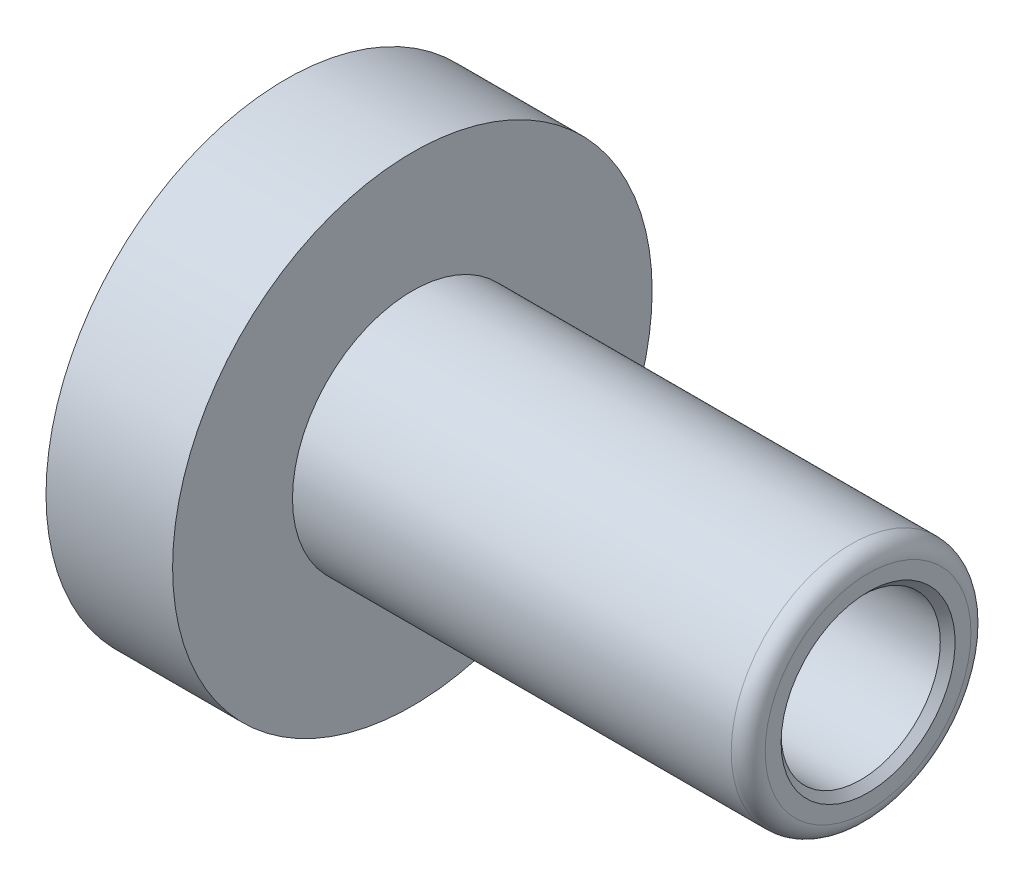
SolidWorks part; units mm, degrees
ref_plane "Front Plane" through (0, 0, 0) normal (0, 0, 1) x (1, 0, 0)
ref_plane "Top Plane" through (0, 0, 0) normal (0, 1, 0) x (1, 0, 0)
ref_plane "Right Plane" through (0, 0, 0) normal (1, 0, 0) x (0, 0, -1)
sketch "Sketch1" plane through (0, 0, 0) normal (0, 0, 1) x (1, 0, 0)
  line L0 (0, 0) -> (102.3864, 0) construction
  line L1 (0, 8.128) -> (0, 22.225)
  line L2 (0, 22.225) -> (11.7348, 22.225)
  line L3 (11.7348, 22.225) -> (11.7348, 11.1125)
  line L4 (11.7348, 11.1125) -> (52.4002, 11.1125)
  line L5 (53.975, 9.5377) -> (53.975, 0)
  line L6 (53.975, 0) -> (28.067, 0)
  line L7 (0, 8.128) -> (28.067, 8.128)
  line L8 (28.067, 8.128) -> (28.067, 0)
  arc A0 (53.975, 9.5377) -> (52.4002, 11.1125) centre (52.4002, 9.5377) ccw
  dimension "D5" = 1.5748
  dimension "D1" = 11.7348
  dimension "D2" = 44.45
  dimension "D3" = 28.067
  dimension "D4" = 16.256
  dimension "D6" = 53.975
  dimension "D7" = 22.225
revolve "Revolve1" add sketch "Sketch1" angle 360 about L0
sketch "Sketch2" plane through (0, 0, 0) normal (-1, 0, 0) x (0, 0, 1)
  line L0 (0, 0) -> (9.7644, 0) construction
  circle A0 centre (0, 12.7) radius 3.2004
  circle A1 centre (0, -12.7) radius 3.2004
  dimension "D2" = 6.4008
  dimension "D1" = 25.4
extrude "Cut-Extrude1" cut sketch "Sketch2" against normal blind 7.9502
sketch "Sketch3" plane through (53.975, 0, 0) normal (1, 0, 0) x (0, 0, -1)
  circle A0 centre (0, 0) radius 7.3787
  dimension "D1" = 14.7574
extrude "Cut-Extrude2" cut sketch "Sketch3" against normal blind 22.8092
chamfer "Chamfer1" distance 0.6858 angle 45 1 edges at (53.975, 0, -7.3787)
